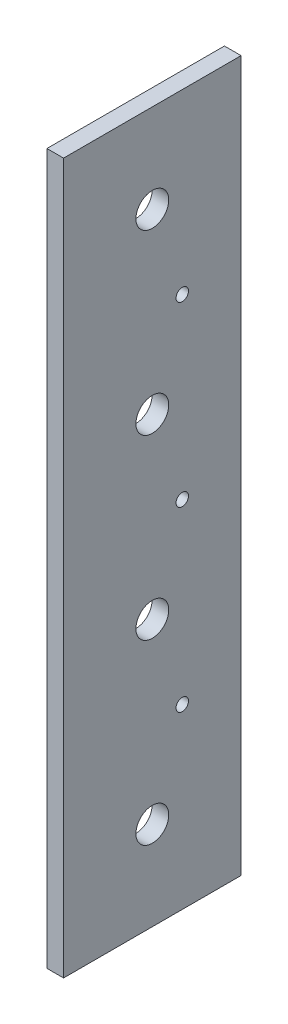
SolidWorks part; units mm, degrees
ref_plane "Front Plane" through (0, 0, 0) normal (0, 0, 1) x (1, 0, 0)
ref_plane "Top Plane" through (0, 0, 0) normal (0, 1, 0) x (1, 0, 0)
ref_plane "Right Plane" through (0, 0, 0) normal (1, 0, 0) x (0, 0, -1)
sketch "Sketch1" plane through (0, 0, 0) normal (1, 0, 0) x (0, 0, -1)
  line L1 (-25.4, -101.6) -> (25.4, -101.6)
  line L2 (-25.4, -101.6) -> (-25.4, 101.6)
  line L3 (-25.4, 101.6) -> (25.4, 101.6)
  line L4 (25.4, -101.6) -> (25.4, 101.6)
  line L5 (0, 101.6) -> (0, -101.6) construction
  line L6 (-25.4, 0) -> (25.4, 0) construction
  point P0 (0, 0)
  dimension "D1" = 203.2
  dimension "D2" = 50.8
extrude "Boss-Extrude1" add sketch "Sketch1" along normal blind 4.7625
sketch "Sketch2" plane through (0, 0, 0) normal (-1, 0, 0) x (0, 0, 1)
  circle A0 centre (0, -76.2) radius 4.699 construction
  circle A1 centre (0, -25.4) radius 4.699 construction
  circle A2 centre (0, 25.4) radius 4.699 construction
  circle A3 centre (0, 76.2) radius 4.699 construction
  circle A4 centre (0, -76.2) radius 4.699
  circle A5 centre (0, -25.4) radius 4.699
  circle A6 centre (0, 25.4) radius 4.699
  circle A7 centre (0, 76.2) radius 4.699
  circle A8 centre (-8.5725, -50.8) radius 1.778 construction
  circle A9 centre (-8.5725, -50.8) radius 1.778
  circle A10 centre (-8.5725, 50.8) radius 1.778 construction
  circle A11 centre (-8.5725, 0) radius 1.778 construction
  circle A12 centre (-8.5725, 50.8) radius 1.778
  circle A13 centre (-8.5725, 0) radius 1.778
  point P22 (0, 25.4)
  point P23 (0, -25.4)
  point P24 (0, -76.2)
extrude "Cut-Extrude1" cut sketch "Sketch2" against normal through all
